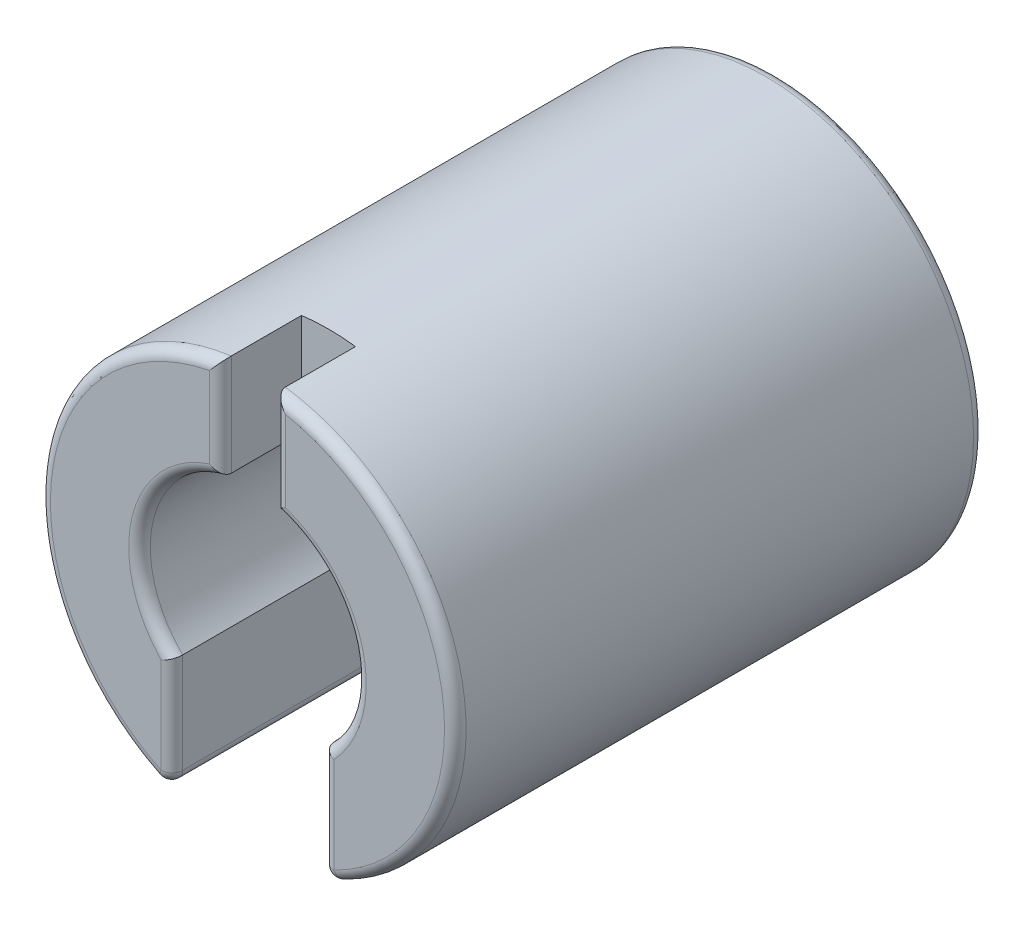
SolidWorks part; units mm, degrees
ref_plane "前视基准面" through (0, 0, 0) normal (0, 0, 1) x (1, 0, 0)
ref_plane "上视基准面" through (0, 0, 0) normal (0, 1, 0) x (1, 0, 0)
ref_plane "右视基准面" through (0, 0, 0) normal (1, 0, 0) x (0, 0, -1)
sketch "草图1" plane through (0, 0, 0) normal (0, 0, 1) x (1, 0, 0)
  line L2 (-1.4, -3.5864) -> (-1.4, -1.4283)
  line L4 (1.4, -3.5864) -> (1.4, -1.4283)
  arc A0 (1.4, -3.5864) -> (-1.4, -3.5864) centre (0, 0) ccw
  arc A1 (1.4, -1.4283) -> (-1.4, -1.4283) centre (0, 0) ccw
extrude "凸台-拉伸1" add sketch "草图1" along normal blind 9.8
sketch "草图2" plane through (0, 0, 9.8) normal (0, 0, 1) x (1, 0, 0)
  line L2 (-0.5, 1.9365) -> (-0.5, 3.8174)
  line L4 (0.5, 1.9365) -> (0.5, 3.8174)
  arc A0 (0.5, 1.9365) -> (-0.5, 1.9365) centre (0, 0) ccw
  arc A1 (0.5, 3.8174) -> (-0.5, 3.8174) centre (0, 0) ccw
extrude "切除-拉伸1" cut sketch "草图2" against normal blind 1.5
sketch "草图3" plane through (0, 0, 0) normal (0, 0, -1) x (-1, 0, 0)
  line L0 (-1.7678, -1.7678) -> (-2.4749, -2.4749)
  line L1 (1.7678, -1.7678) -> (2.4749, -2.4749)
  arc A0 (1.7678, -1.7678) -> (-1.7678, -1.7678) centre (0, 0) ccw
  arc A1 (2.4749, -2.4749) -> (-2.4749, -2.4749) centre (0, 0) ccw
extrude "切除-拉伸2" cut sketch "草图3" against normal blind 1.5
sketch "草图4" plane through (0, 0, 0) normal (0, 0, -1) x (-1, 0, 0)
  line L2 (-0.5, 1.9365) -> (-0.5, 2.245)
  line L4 (0.5, 1.9365) -> (0.5, 2.245)
  arc A0 (0.5, 1.9365) -> (-0.5, 1.9365) centre (0, 0) ccw
  arc A1 (0.5, 2.245) -> (-0.5, 2.245) centre (0, 0) ccw
extrude "切除-拉伸3" cut sketch "草图4" against normal through all
fillet "圆角1" radius 0.2 11 edges at (-1.9321, 0.5168, 9.8) (-1.4, -2.5074, 9.8) (-3.8219, 0.4646, 9.8) (-0.5, 2.8769, 9.8) (3.8219, 0.4646, 9.8) (1.4, -2.5074, 9.8) (1.9321, 0.5168, 9.8) (0.5, 2.8769, 9.8) (0, 3.85, 0) (1.4, -3.5864, 4.9) (-1.4, -3.5864, 4.9)
